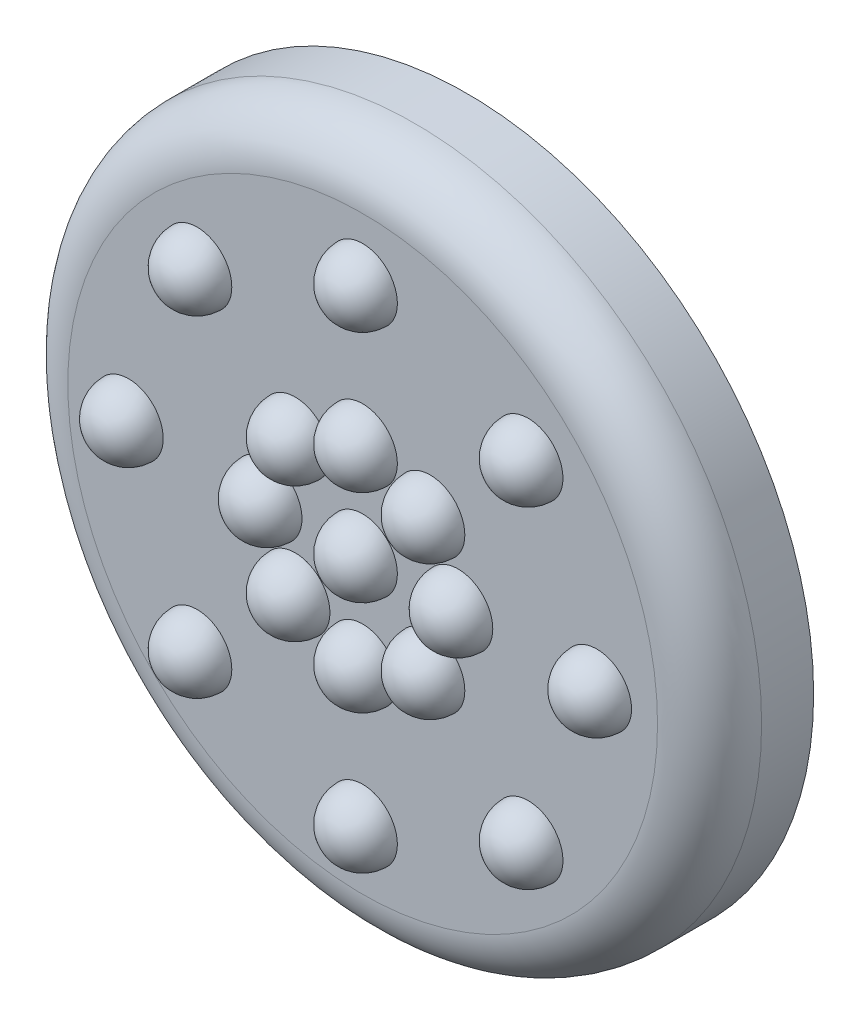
SolidWorks part; units mm, degrees
ref_plane "Piano frontale" through (0, 0, 0) normal (0, 0, 1) x (1, 0, 0)
ref_plane "Piano superiore" through (0, 0, 0) normal (0, 1, 0) x (1, 0, 0)
ref_plane "Piano destro" through (0, 0, 0) normal (1, 0, 0) x (0, 0, -1)
sketch "Sketch1" plane through (0, 0, 0) normal (0, 0, 1) x (1, 0, 0)
  circle A0 centre (0, 0) radius 100
  dimension "D1" = 200
extrude "Boss-Extrude1" add sketch "Sketch1" along normal blind 30
fillet "Fillet1" radius 15 1 edges at (100, 0, 30)
sketch "Sketch2" plane through (0, 0, 30) normal (0, 0, 1) x (1, 0, 0)
  line L0 (0, 0) -> (0, -109.2815) construction
  line L1 (-10, -67.5) -> (10, -67.5) construction
  line L2 (-10, -67.5) -> (10, -67.5)
  arc A1 (-10, -67.5) -> (10, -67.5) centre (0, -67.5) ccw
  circle A2 centre (0, 0) radius 85 construction
  dimension "D3" = 20
  dimension "D5" = 67.5
  dimension "D4" = 0
revolve "Revolve2" add sketch "Sketch2" angle 360 about L2
sketch "Sketch4" plane through (0, 0, 30) normal (0, 0, 1) x (1, 0, 0)
  line L0 (0, -110.3705) -> (0, 95.7433) construction
  line L1 (0, -42.6914) -> (0, -49.6377)
  point P3 (0, -7.3136)
pattern_linear "LPattern1" count 2 spacing 40 along (0, 1, 0) of "Revolve2"
pattern_circular "CirPattern2" count 8 over 360 about axis through (0, 0, 0) along (0, 0, 1) of "Revolve2", "LPattern1"
sketch "Sketch6" plane through (0, 0, 30) normal (0, 0, 1) x (1, 0, 0)
  line L0 (10, 0) -> (-10, 0)
  arc A0 (-10, 0) -> (10, 0) centre (0, 0) ccw
  dimension "D1" = 20
revolve "Revolve3" add sketch "Sketch6" angle 360 about L0
